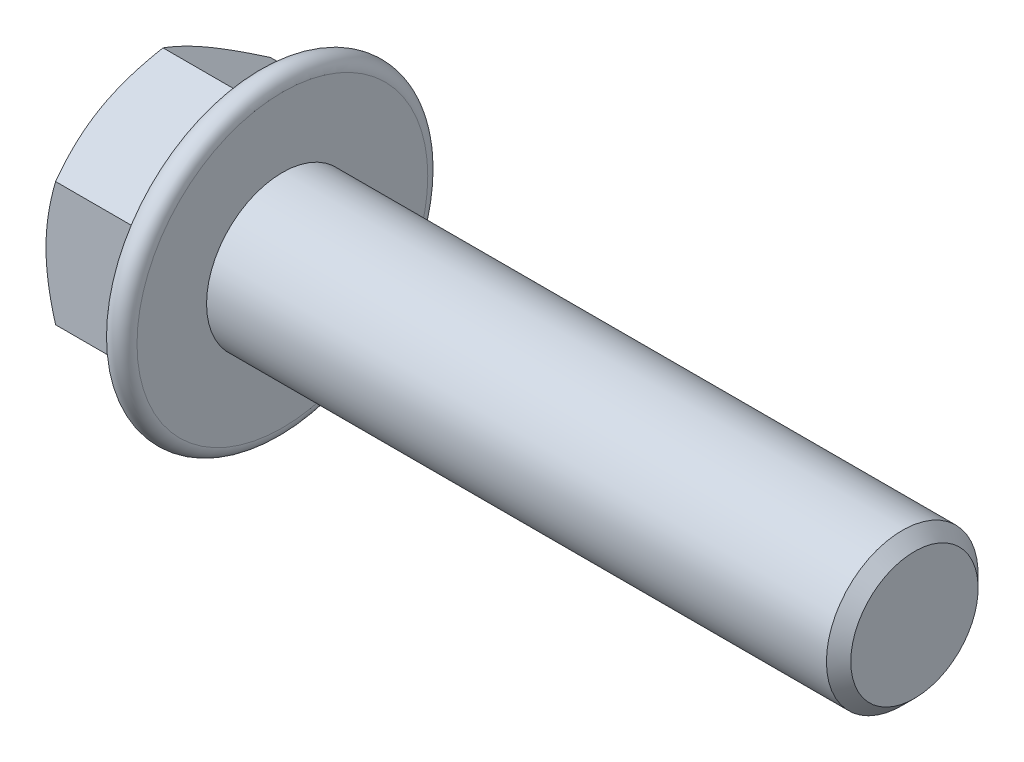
SolidWorks part; units mm, degrees
extrude "BaseHead" add sketch "Sketch1" along normal blind 10.2
sketch "Sketch1" plane through (0, 0, 0) normal (1, 0, 0) x (0, 0, -1)
  line L0 (8.5, 4.9075) -> (8.5, -4.9075)
  line L1 (-8.5, 4.9075) -> (-8.5, -4.9075)
  line L2 (8.5, -4.9075) -> (0, -9.815)
  line L3 (0, -9.815) -> (-8.5, -4.9075)
  line L4 (8.5, 4.9075) -> (0, 9.815)
  line L5 (0, 9.815) -> (-8.5, 4.9075)
ref_plane "Plane1" through (0, 0, 0) normal (0, 0, 1) x (1, 0, 0)
ref_plane "Plane2" through (0, 0, 0) normal (0, 1, 0) x (1, 0, 0)
ref_plane "Plane3" through (0, 0, 0) normal (1, 0, 0) x (0, 0, -1)
other "Configuration Table"
sketch "BodySke" plane through (0, 0, 0) normal (0, 0, 1) x (1, 0, 0)
  line L0 (0, 4.9075) -> (0, -4.9075) construction
  line L1 (0, 0) -> (60.2, 0)
  line L2 (0, 0) -> (0, 6)
  line L3 (0, 6) -> (59.236, 6)
  line L4 (60.2, 0) -> (60.2, 5.036)
  line L5 (10.2, 9.815) -> (10.2, 4.9075) construction
  line L6 (60.2, 5.036) -> (59.236, 6)
  line L7 (0, 0) -> (96.52, 0) construction
  line L8 (60.2, -5.036) -> (59.236, -6) construction
  line L9 (0, -6) -> (59.236, -6) construction
  line L10 (11.95, 15.24) -> (11.95, -1.27) construction
  line L11 (30.2, 15.24) -> (30.2, -1.27) construction
  line L12 (10.2, 4.9075) -> (10.2, -4.9075) construction
revolve "BaseBody" add sketch "BodySke" angle 360 about L7
sketch "Sketch3" plane through (0, 0, 0) normal (0, 0, 1) x (1, 0, 0)
  line L0 (0, 8.5) -> (3.6459, 14.815)
  line L1 (0, 9.815) -> (0, 4.9075) construction
  line L2 (3.6459, 14.815) -> (3.6459, 19.815)
  line L3 (3.6459, 19.815) -> (-10, 19.815)
  line L4 (-10, 19.815) -> (-10, 8.5)
  line L5 (-10, 8.5) -> (0, 8.5)
  line L6 (0, 0) -> (99.06, 0) construction
  line L7 (10.2, 9.815) -> (0, 9.815) construction
revolve "HeadChamfer" cut sketch "Sketch3" angle 360 about L6
sketch "Sketch4" plane through (0, 0, 0) normal (0, 0, 1) x (1, 0, 0)
  line L0 (8.1799, 0) -> (8.2, 11.5017)
  line L1 (10.2, 9.815) -> (10.2, 4.9075) construction
  line L2 (8.2, 34.3444) -> (8.2, 16.9779) construction
  line L3 (10.2, 0) -> (10.2, 11.5)
  line L4 (8.3021, 12.5) -> (20.1618, 12.5) construction
  line L5 (0, 0) -> (95.25, 0) construction
  line L6 (0, 0) -> (96.52, 0) construction
  line L7 (8.1799, 0) -> (10.2, 0)
  line L8 (8.3021, -12.5) -> (20.1618, -12.5) construction
  arc A0 (10.2, 11.5) -> (8.2, 11.5017) centre (9.2, 11.5) ccw
  dimension "D1" = 0.1
  dimension "Flange_thickness" = 2
  dimension "Flange_dia" = 25
revolve "Flange" add sketch "Sketch4" angle 360 about L5
fillet "FlangeHexFillet" radius 0.8 6 edges
fillet "HeadFillet" [suppressed] radius 0.8
sketch "ThdSchSke" plane through (0, 0, 0) normal (0, 0, 1) x (1, 0, 0)
  line L0 (30.2, -5.036) -> (29.525, -6)
  line L1 (30.2, -5.036) -> (30.875, -6)
  line L2 (30.875, -6) -> (30.875, -7.5)
  line L3 (-3.175, 0) -> (5.1513, 0) construction
  line L5 (30.875, -7.5) -> (29.525, -7.5)
  line L6 (29.525, -7.5) -> (29.525, -6)
revolve "ThreadSchematic" [suppressed] cut sketch "ThdSchSke" angle 360 about L3
pattern_linear "ThdSchPat" [suppressed]
equation "\"D3@Sketch1\" = \"Width_flats@Sketch1\" / 2"
equation "\"D4@Sketch1\" = \"D3@Sketch1\""
equation "\"D5@Sketch1\" = \"D4@Sketch1\""
equation "\"Thread_minor@ThreadCosmetic\" = \"Minor_dia@BodySke\""
equation "\"D1@Sketch3\" = \"Width_flats@Sketch1\" / 2"
equation "\"Thread_length@ThreadCosmetic\" = ((sgn( (\"Length@BodySke\" - \"Advance@BodySke\" * 2 ) - \"Thread_nom@BodySke\" )-1)*( (\"Length@BodySke\" - \"Advance@BodySke\" * 2 ) - \"Thread_nom@BodySke\" ))/-2+ \"Thread_nom@"
equation "\"Thread_minor@ThdSchSke\" = \"Minor_dia@BodySke\""
equation "\"Diameter@ThdSchSke\" = \"Diameter@BodySke\""
equation "\"Overcut@ThdSchSke\" = \"Diameter@BodySke\" * 1.25"
equation "\"Start@ThdSchSke\" = \"Head_ht@BaseHead\" + \"Length@BodySke\" - \"Thread_length@ThreadCosmetic\"  '---Non-countersunk---"
equation "\"Num_threads@ThdSchPat\" = int( \"Thread_length@ThreadCosmetic\" / \"Advance@BodySke\" + 0.999 )  + 1"
equation "\"Advance@ThdSchPat\" = \"Thread_length@ThreadCosmetic\" /  (\"Num_threads@ThdSchPat\" - 1) 'relax it"
equation "\"Num_threads@ThdSchPat\" = \"Num_threads@ThdSchPat\" - sgn( \"Num_threads@ThdSchPat\" - 1) '---chamfered tips only---"
